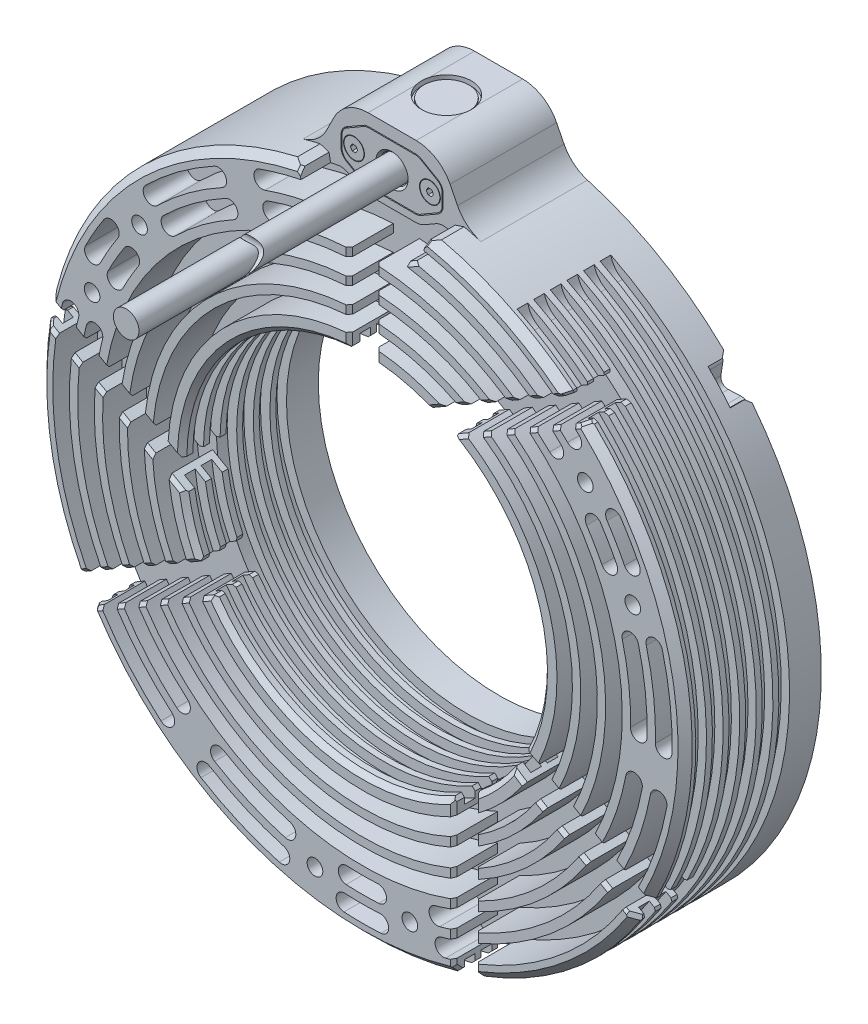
SolidWorks part; units mm, degrees
ref_plane "Front Plane" through (0, 0, 0) normal (0, 0, 1) x (1, 0, 0)
ref_plane "Top Plane" through (0, 0, 0) normal (0, 1, 0) x (1, 0, 0)
ref_plane "Right Plane" through (0, 0, 0) normal (1, 0, 0) x (0, 0, -1)
imported_body "Imported1"
sketch "Sketch1" plane through (0, 0, 18.45) normal (0, 0, 1) x (1, 0, 0)
  circle A0 centre (-0.0259, 69.0167) radius 2.7
  circle A1 centre (-0.0259, 69.0167) radius 2.9 construction
  dimension "D1" = 5.4
extrude "Boss-Extrude1" add sketch "Sketch1" along normal blind 60
sketch "Sketch2" plane through (0, 0, 0) normal (1, 0, 0) x (0, 0, -1)
  line L0 (-53.45, 72.2667) -> (-53.45, 65.7667) construction
  line L1 (-53.45, 69.0167) -> (-78.45, 69.0167) construction
  line L2 (-78.45, 71.7167) -> (-78.45, 66.3167) construction
  arc A2 (-53.7022, 71.835) -> (-53.1978, 72.6985) centre (-53.45, 72.2667) cw
  arc A3 (-53.675, 65.3202) -> (-53.225, 66.2133) centre (-53.45, 65.7667) ccw
  spline S0 degree 3 poles (-53.45, 72.2667) (-51.474, 71.1125) (-53.3586, 68.8858) (-55.8343, 66.968) (-53.45, 65.7667) knots 0 0 0 0 0.487049 1 1 1 1 construction
  spline S1 degree 1 poles (-53.7022, 71.835) (-53.675, 65.3202) knots 0 0 1 1 construction
  spline S2 degree 3 poles (-53.7022, 71.835) (-53.5968, 71.7734) (-53.377, 71.6328) (-53.0715, 71.3889) (-52.85, 71.1174) (-52.7789, 70.8931) (-52.7894, 70.6784) (-52.9075, 70.3876) (-53.2282, 69.9309) (-53.8648, 69.3041) (-54.7111, 68.5224) (-55.2771, 67.7618) (-55.3312, 66.906) (-55.0389, 66.294) (-54.5915, 65.8725) (-54.1196, 65.557) (-53.8206, 65.3936) (-53.675, 65.3202) knots 0 0 0 0 0.03125 0.0625 0.125 0.1875 0.25 0.3125 0.375 0.5 0.625 0.75 0.8125 0.875 0.9375 0.96875 1 1 1 1
  spline S3 degree 1 poles (-53.1978, 72.6985) (-53.225, 66.2133) knots 0 0 1 1 construction
  spline S4 degree 3 poles (-53.1978, 72.6985) (-53.0671, 72.6221) (-52.802, 72.4528) (-52.38, 72.1185) (-51.9843, 71.6631) (-51.7556, 71.0346) (-51.825, 70.2003) (-52.3516, 69.3861) (-53.1975, 68.5595) (-53.8684, 67.9395) (-54.2, 67.511) (-54.3064, 67.2595) (-54.308, 67.1198) (-54.2382, 66.9323) (-53.9705, 66.6611) (-53.6075, 66.4173) (-53.3483, 66.2754) (-53.225, 66.2133) knots 0 0 0 0 0.03125 0.0625 0.125 0.1875 0.25 0.375 0.5 0.625 0.6875 0.75 0.8125 0.875 0.9375 0.96875 1 1 1 1
  dimension "D1" = 25
  dimension "D2" = 6.5
  dimension "D3" = 0.5
  dimension "D4" = 0.5
extrude "Cut-Extrude1" cut sketch "Sketch2" against normal through all both and the other way through all
sketch "Sketch3" [suppressed] plane through (0, 0, 0) normal (0, 0, -1) x (-1, 0, 0)
  line L18 (-16.5369, -64.0795) -> (-14.4522, -62.409)
  line L19 (-12.1813, -62.8918) -> (-10.9563, -65.2658)
  line L20 (63.763, 17.7184) -> (61.2739, 18.6885)
  line L21 (60.5565, 20.8966) -> (61.9999, 23.1445)
  line L22 (12.692, 69.0798) -> (11.1564, 72.1397)
  line L23 (4.9001, 76) -> (-4.9001, 76)
  line L24 (-11.1564, 72.1397) -> (-12.692, 69.0798)
  line L25 (-47.226, 46.3612) -> (-46.8217, 43.7205)
  line L26 (-48.3752, 41.9952) -> (-51.0437, 42.1213)
  line L27 (-16.5369, -64.0795) -> (-14.4522, -62.409)
  line L28 (-12.1813, -62.8918) -> (-10.9563, -65.2658)
  line L29 (63.763, 17.7184) -> (61.2739, 18.6885)
  line L30 (60.5565, 20.8966) -> (61.9999, 23.1445)
  line L31 (12.692, 69.0798) -> (11.1564, 72.1397)
  line L32 (4.9001, 76) -> (-4.9001, 76)
  line L33 (-11.1564, 72.1397) -> (-12.692, 69.0798)
  line L34 (-47.226, 46.3612) -> (-46.8217, 43.7205)
  line L35 (-48.3752, 41.9952) -> (-51.0437, 42.1213)
  circle A19 centre (0, 0) radius 39
  circle A20 centre (0, 0) radius 39
  arc A34 (-18.3349, -64.4425) -> (-16.5369, -64.0795) centre (-17.7876, -62.5188) ccw
  arc A35 (-12.1813, -62.8918) -> (-14.4522, -62.409) centre (-13.5143, -63.5796) ccw
  arc A36 (-10.9563, -65.2658) -> (-9.4614, -66.3286) centre (-9.1789, -64.3486) ccw
  arc A37 (-9.4614, -66.3286) -> (64.9763, 16.3428) centre (0, 0) ccw
  arc A38 (64.9763, 16.3428) -> (63.763, 17.7184) centre (63.0367, 15.8549) ccw
  arc A39 (60.5565, 20.8966) -> (61.2739, 18.6885) centre (61.8187, 20.0861) ccw
  arc A40 (61.9999, 23.1445) -> (62.1729, 24.9705) centre (60.317, 24.2251) ccw
  arc A41 (62.1729, 24.9705) -> (18.2804, 64.458) centre (0, 0) ccw
  arc A42 (12.692, 69.0798) -> (18.2804, 64.458) centre (20.736, 73.1165) ccw
  arc A43 (11.1564, 72.1397) -> (4.9001, 76) centre (4.9001, 69) ccw
  arc A44 (-4.9001, 76) -> (-11.1564, 72.1397) centre (-4.9001, 69) ccw
  arc A45 (-18.2804, 64.458) -> (-12.692, 69.0798) centre (-20.736, 73.1165) ccw
  arc A46 (-18.2804, 64.458) -> (-46.6414, 48.0997) centre (0, 0) ccw
  arc A47 (-46.6414, 48.0997) -> (-47.226, 46.3612) centre (-45.2491, 46.6639) ccw
  arc A48 (-48.3752, 41.9952) -> (-46.8217, 43.7205) centre (-48.3044, 43.4935) ccw
  arc A49 (-51.0437, 42.1213) -> (-52.7116, 41.3581) centre (-51.1381, 40.1235) ccw
  arc A50 (-52.7116, 41.3581) -> (-18.3349, -64.4425) centre (0, 0) ccw
  arc A51 (-18.3349, -64.4425) -> (-16.5369, -64.0795) centre (-17.7876, -62.5188) ccw
  arc A52 (-12.1813, -62.8918) -> (-14.4522, -62.409) centre (-13.5143, -63.5796) ccw
  arc A53 (-10.9563, -65.2658) -> (-9.4614, -66.3286) centre (-9.1789, -64.3486) ccw
  arc A54 (-9.4614, -66.3286) -> (64.9763, 16.3428) centre (0, 0) ccw
  arc A55 (64.9763, 16.3428) -> (63.763, 17.7184) centre (63.0367, 15.8549) ccw
  arc A56 (60.5565, 20.8966) -> (61.2739, 18.6885) centre (61.8187, 20.0861) ccw
  arc A57 (61.9999, 23.1445) -> (62.1729, 24.9705) centre (60.317, 24.2251) ccw
  arc A58 (62.1729, 24.9705) -> (18.2804, 64.458) centre (0, 0) ccw
  arc A59 (12.692, 69.0798) -> (18.2804, 64.458) centre (20.736, 73.1165) ccw
  arc A60 (11.1564, 72.1397) -> (4.9001, 76) centre (4.9001, 69) ccw
  arc A61 (-4.9001, 76) -> (-11.1564, 72.1397) centre (-4.9001, 69) ccw
  arc A62 (-18.2804, 64.458) -> (-12.692, 69.0798) centre (-20.736, 73.1165) ccw
  arc A63 (-18.2804, 64.458) -> (-46.6414, 48.0997) centre (0, 0) ccw
  arc A64 (-46.6414, 48.0997) -> (-47.226, 46.3612) centre (-45.2491, 46.6639) ccw
  arc A65 (-48.3752, 41.9952) -> (-46.8217, 43.7205) centre (-48.3044, 43.4935) ccw
  arc A66 (-51.0437, 42.1213) -> (-52.7116, 41.3581) centre (-51.1381, 40.1235) ccw
  arc A67 (-52.7116, 41.3581) -> (-18.3349, -64.4425) centre (0, 0) ccw
  dimension "D1" = 0
  dimension "D2" = 0
extrude "Cut-Extrude2" [suppressed] cut sketch "Sketch3" against normal up to surface and the other way through all
sketch "Sketch4" [suppressed] plane through (0, 0, 1) normal (0, 0, -1) x (-1, 0, 0)
  line L8 (60.5565, 20.8966) -> (61.9999, 23.1445)
  line L9 (63.763, 17.7184) -> (61.2739, 18.6885)
  line L10 (60.5565, 20.8966) -> (61.9999, 23.1445)
  line L11 (63.763, 17.7184) -> (61.2739, 18.6885)
  line L12 (-16.5369, -64.0795) -> (-14.4522, -62.409)
  line L13 (-12.1813, -62.8918) -> (-10.9563, -65.2658)
  line L14 (-16.5369, -64.0795) -> (-14.4522, -62.409)
  line L15 (-12.1813, -62.8918) -> (-10.9563, -65.2658)
  line L22 (-48.3752, 41.9952) -> (-51.0437, 42.1213)
  line L23 (-47.226, 46.3612) -> (-46.8217, 43.7205)
  line L24 (-48.3752, 41.9952) -> (-51.0437, 42.1213)
  line L25 (-47.226, 46.3612) -> (-46.8217, 43.7205)
  circle A0 centre (0, 0) radius 67
  arc A1 (62.1729, 24.9705) -> (18.2804, 64.458) centre (0, 0) ccw construction
  arc A14 (61.9999, 23.1445) -> (62.1729, 24.9705) centre (60.317, 24.2251) ccw
  arc A15 (60.5565, 20.8966) -> (61.2739, 18.6885) centre (61.8187, 20.0861) ccw
  arc A16 (64.9763, 16.3428) -> (63.763, 17.7184) centre (63.0367, 15.8549) ccw
  arc A17 (61.9999, 23.1445) -> (62.1729, 24.9705) centre (60.317, 24.2251) ccw
  arc A18 (60.5565, 20.8966) -> (61.2739, 18.6885) centre (61.8187, 20.0861) ccw
  arc A19 (64.9763, 16.3428) -> (63.763, 17.7184) centre (63.0367, 15.8549) ccw
  arc A21 (-18.3349, -64.4425) -> (-16.5369, -64.0795) centre (-17.7876, -62.5188) ccw
  arc A22 (-12.1813, -62.8918) -> (-14.4522, -62.409) centre (-13.5143, -63.5796) ccw
  arc A23 (-10.9563, -65.2658) -> (-9.4614, -66.3286) centre (-9.1789, -64.3486) ccw
  arc A24 (-18.3349, -64.4425) -> (-16.5369, -64.0795) centre (-17.7876, -62.5188) ccw
  arc A25 (-12.1813, -62.8918) -> (-14.4522, -62.409) centre (-13.5143, -63.5796) ccw
  arc A26 (-10.9563, -65.2658) -> (-9.4614, -66.3286) centre (-9.1789, -64.3486) ccw
  arc A36 (-51.0437, 42.1213) -> (-52.7116, 41.3581) centre (-51.1381, 40.1235) ccw
  arc A37 (-48.3752, 41.9952) -> (-46.8217, 43.7205) centre (-48.3044, 43.4935) ccw
  arc A38 (-46.6414, 48.0997) -> (-47.226, 46.3612) centre (-45.2491, 46.6639) ccw
  arc A39 (-51.0437, 42.1213) -> (-52.7116, 41.3581) centre (-51.1381, 40.1235) ccw
  arc A40 (-48.3752, 41.9952) -> (-46.8217, 43.7205) centre (-48.3044, 43.4935) ccw
  arc A41 (-46.6414, 48.0997) -> (-47.226, 46.3612) centre (-45.2491, 46.6639) ccw
  dimension "D1" = 0
  dimension "D2" = 0
  dimension "D3" = 0
extrude "Boss-Extrude2" [suppressed] add sketch "Sketch4" against normal up to surface (3 mm away) contours A0 M25 M29 M28 M27 M26 | A0 M19 M23 M22 M21 M20 | A0 M39 M43 M42 M41 M40
